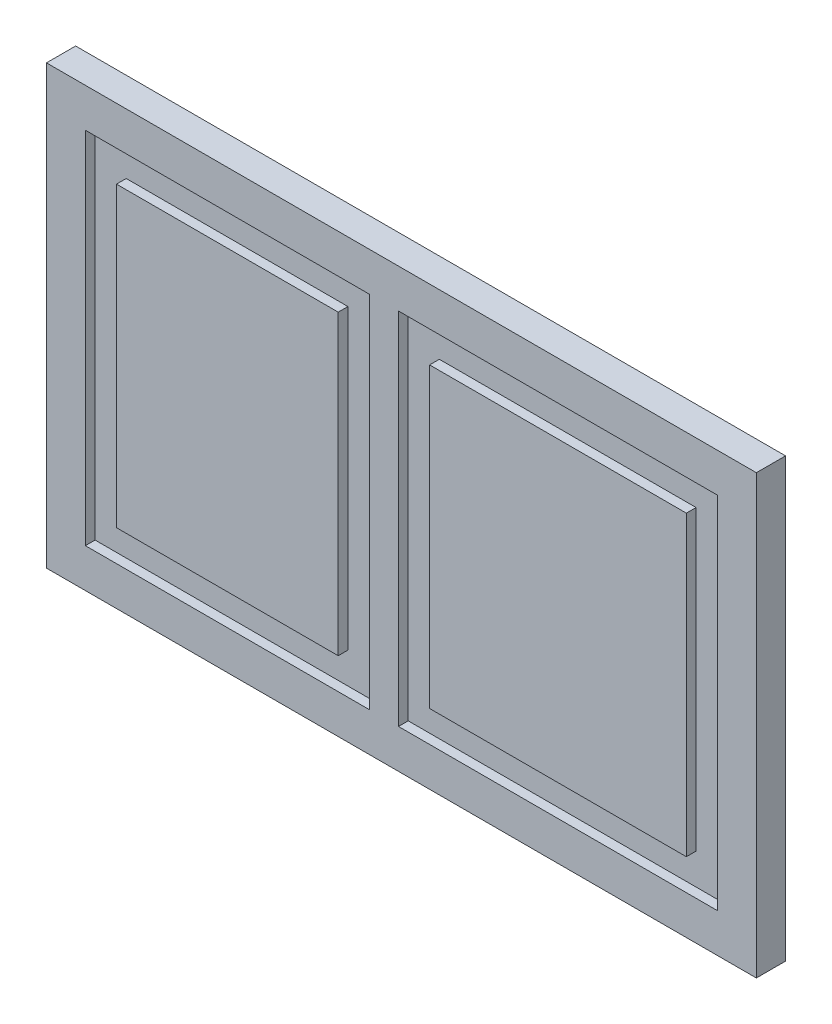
SolidWorks part; units mm, degrees
ref_plane "Plan de face" through (0, 0, 0) normal (0, 0, 1) x (1, 0, 0)
ref_plane "Plan de dessus" through (0, 0, 0) normal (0, 1, 0) x (1, 0, 0)
ref_plane "Plan de droite" through (0, 0, 0) normal (1, 0, 0) x (0, 0, -1)
sketch "Esquisse1" plane through (0, 0, 0) normal (0, 0, 1) x (1, 0, 0)
  line L1 (-30, 40) -> (43, 40)
  line L2 (-30, 40) -> (-30, -5)
  line L3 (-30, -5) -> (43, -5)
  line L4 (43, 40) -> (43, -5)
  dimension "D1" = 73
  dimension "D2" = 45
extrude "Extrusion1" add sketch "Esquisse1" along normal blind 3
sketch "Esquisse2" plane through (0, 0, 3) normal (0, 0, 1) x (1, 0, 0)
  line L0 (43, -5) -> (43, 40) construction
  line L1 (-26, 36) -> (3.2, 36)
  line L2 (-26, 36) -> (-26, -1)
  line L3 (-26, -1) -> (3.2, -1)
  line L4 (3.2, 36) -> (3.2, -1)
  line L5 (39, 36) -> (6.2, 36)
  line L6 (39, 36) -> (39, -1)
  line L7 (39, -1) -> (6.2, -1)
  line L8 (6.2, 36) -> (6.2, -1)
  line L9 (43, 40) -> (-30, 40) construction
  line L10 (-30, -5) -> (43, -5) construction
  line L11 (-30, 40) -> (-30, -5) construction
  line L13 (-22.8, 32.8) -> (0, 32.8)
  line L14 (-22.8, 32.8) -> (-22.8, 2.2)
  line L15 (-22.8, 2.2) -> (0, 2.2)
  line L16 (0, 32.8) -> (0, 2.2)
  line L17 (9.4, 32.8) -> (35.8, 32.8)
  line L18 (9.4, 32.8) -> (9.4, 2.2)
  line L19 (9.4, 2.2) -> (35.8, 2.2)
  line L20 (35.8, 32.8) -> (35.8, 2.2)
  dimension "D1" = 4
  dimension "D2" = 4
  dimension "D3" = 4
  dimension "D4" = 4
  dimension "D5" = 4
  dimension "D6" = 4
  dimension "D7" = 3
  dimension "D8" = 3.2
  dimension "D9" = 3.2
  dimension "D10" = 3.2
  dimension "D11" = 3.2
  dimension "D12" = 3.2
  dimension "D13" = 3.2
  dimension "D14" = 3.2
  dimension "D15" = 3.2
extrude "Enlèv. mat.-Extru.1" cut sketch "Esquisse2" against normal blind 1
